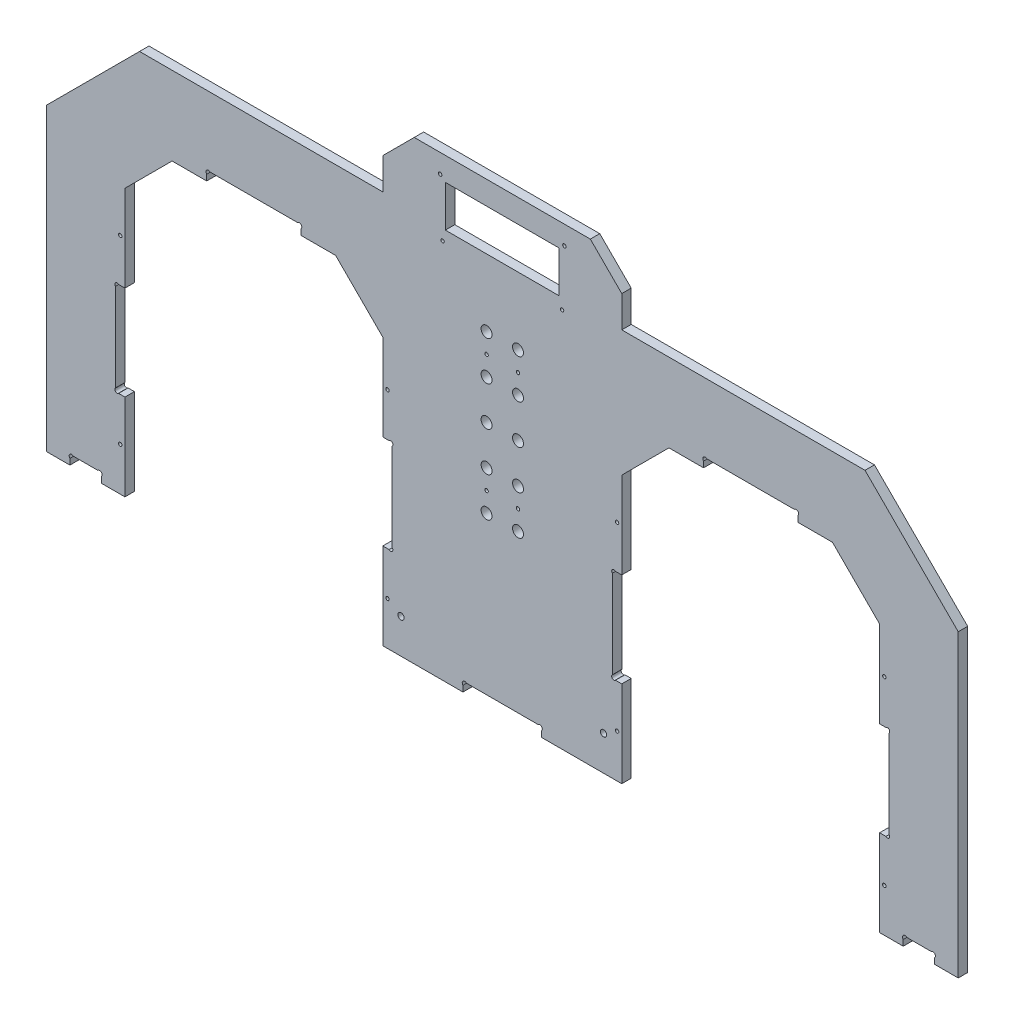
SolidWorks part; units mm, degrees
ref_plane "Plan de face" through (0, 0, 0) normal (0, 0, 1) x (1, 0, 0)
ref_plane "Plan de dessus" through (0, 0, 0) normal (0, 1, 0) x (1, 0, 0)
ref_plane "Plan de droite" through (0, 0, 0) normal (1, 0, 0) x (0, 0, -1)
sketch "Esquisse1" plane through (0, 0, 0) normal (0, 0, 1) x (1, 0, 0)
  line L0 (0, -73.5394) -> (0, 308.8632) construction
  line L1 (290, -73.5394) -> (290, 262.0971) construction
  line L2 (240, 170) -> (240, 115)
  line L3 (346.4556, 0) -> (-29.7377, 0) construction
  line L4 (329.5923, 200) -> (-38.643, 200) construction
  line L5 (76, -52.8899) -> (76, 272.6787) construction
  line L6 (240, 204.2828) -> (240, -52.8899) construction
  line L7 (345.8617, 250) -> (65.5103, 250) construction
  line L8 (56, 290) -> (76, 270)
  line L9 (230.7107, 250) -> (290, 190.7107)
  line L10 (210, 200) -> (240, 170)
  line L11 (158, 29.6271) -> (158, -21.2823) construction
  line L12 (76, 270) -> (76, 250)
  line L13 (76, 250) -> (230.7107, 250)
  line L14 (240, 0) -> (255, 0)
  line L15 (290, 190.7107) -> (290, 0)
  line L16 (210, 200) -> (188, 200)
  line L17 (76, 170) -> (76, 115)
  line L18 (106, 200) -> (76, 170)
  line L19 (-51.0394, 290) -> (95.8133, 290) construction
  line L20 (28.6952, 206) -> (-15.7759, 206) construction
  line L21 (70, -33.1466) -> (70, 219.4286) construction
  line L22 (246, -33.1466) -> (246, 209.1108) construction
  line L23 (329.5923, 206) -> (56, 206) construction
  line L24 (224.6367, 85) -> (240, 85) construction
  line L25 (10, 107.7849) -> (10, 210.6288) construction
  line L26 (220.769, 115) -> (256.0249, 115) construction
  line L27 (246, 115) -> (229.1687, 98.1687) construction
  line L28 (-10, 107.7849) -> (-10, 173.6131) construction
  line L29 (240, 115) -> (244, 115)
  line L30 (246, 113) -> (246, 57)
  line L31 (244, 55) -> (240, 55)
  line L32 (224.6367, 142.5) -> (251.0798, 142.5) construction
  line L33 (240, 55) -> (240, 0)
  line L34 (243, 154.5331) -> (243, 137.1541) construction
  line L35 (72, 55) -> (76, 55)
  line L36 (70, 113) -> (70, 57)
  line L37 (76, 115) -> (72, 115)
  line L38 (128, 206) -> (143.7574, 190.2426) construction
  line L39 (76, 55) -> (76, 0)
  line L40 (158, 200) -> (158, 181.4071) construction
  line L41 (128, 210.6288) -> (128, 181.4071) construction
  line L42 (128, 203.7373) -> (128, 200)
  line L43 (188, 203.7373) -> (188, 200)
  line L44 (130.2627, 206) -> (185.7373, 206)
  line L45 (265, 0) -> (265, -17.758) construction
  line L46 (128, 200) -> (106, 200)
  line L47 (275, 9.5721) -> (275, -17.758) construction
  line L48 (314.8495, 6) -> (-29.7377, 6) construction
  line L49 (275, 6) -> (264.8511, -4.1489) construction
  line L50 (275, 3.7373) -> (275, 0)
  line L51 (255, 3.7373) -> (255, 0)
  line L52 (257.2627, 6) -> (272.7373, 6)
  line L53 (275, 0) -> (290, 0)
  line L54 (25, 9.5721) -> (25, -17.758) construction
  line L55 (20.3719, 22) -> (71, 22) construction
  line L56 (64.4, -11.5037) -> (64.4, 47.2478) construction
  line L57 (25, 6) -> (7.4963, -11.5037) construction
  line L58 (25, 3.7373) -> (25, 0)
  line L59 (25, 0) -> (76, 0)
  line L60 (-56, 290) -> (-76, 270)
  line L61 (-76, 270) -> (-76, 250)
  line L62 (-76, 250) -> (-230.7107, 250)
  line L63 (-230.7107, 250) -> (-290, 190.7107)
  line L64 (-290, 190.7107) -> (-290, 0)
  line L65 (-275, 0) -> (-290, 0)
  line L66 (-257.2627, 6) -> (-272.7373, 6)
  line L67 (-255, 3.7373) -> (-255, 0)
  line L68 (-275, 3.7373) -> (-275, 0)
  line L69 (-240, 0) -> (-255, 0)
  line L70 (-240, 55) -> (-240, 0)
  line L71 (-244, 55) -> (-240, 55)
  line L72 (-246, 113) -> (-246, 57)
  line L73 (-240, 115) -> (-244, 115)
  line L74 (-240, 170) -> (-240, 115)
  line L75 (-210, 200) -> (-240, 170)
  line L76 (-128, 200) -> (-106, 200)
  line L77 (-130.2627, 206) -> (-185.7373, 206)
  line L78 (-188, 203.7373) -> (-188, 200)
  line L79 (-128, 203.7373) -> (-128, 200)
  line L80 (-106, 200) -> (-76, 170)
  line L81 (-76, 170) -> (-76, 115)
  line L82 (-76, 55) -> (-76, 0)
  line L83 (-76, 115) -> (-72, 115)
  line L84 (-70, 113) -> (-70, 57)
  line L85 (-72, 55) -> (-76, 55)
  line L86 (-25, 0) -> (-76, 0)
  line L87 (-25, 3.7373) -> (-25, 0)
  line L88 (-56, 290) -> (56, 290)
  line L89 (-22.7373, 6) -> (22.7373, 6)
  line L90 (-210, 200) -> (-188, 200)
  line L91 (28.6952, 211) -> (-15.7759, 211) construction
  line L92 (0, 262) -> (31.0144, 262) construction
  line L93 (-42, 282) -> (42, 282) construction
  line L94 (-42, 282) -> (-42, 238) construction
  line L95 (-42, 238) -> (42, 238) construction
  line L96 (42, 282) -> (42, 238) construction
  line L97 (-42, 282) -> (42, 238) construction
  line L98 (3.472, 118.5) -> (28.6952, 118.5) construction
  line L99 (28.6952, 193.5) -> (3.472, 193.5) construction
  line L100 (-42, 238) -> (42, 282) construction
  line L101 (-36.2, 275.15) -> (36.2, 275.15)
  line L102 (-36.2, 275.15) -> (-36.2, 248.85)
  line L103 (-36.2, 248.85) -> (36.2, 248.85)
  line L104 (36.2, 275.15) -> (36.2, 248.85)
  line L105 (-36.2, 275.15) -> (36.2, 248.85) construction
  line L106 (-36.2, 248.85) -> (36.2, 275.15) construction
  arc A0 (246, 113) -> (244, 115) centre (245, 114) ccw
  arc A1 (246, 57) -> (244, 55) centre (245, 56) cw
  circle A2 centre (64.4, 22) radius 2
  circle A3 centre (10, 106) radius 3.475
  circle A4 centre (-64.4, 22) radius 2
  circle A5 centre (243, 142.5) radius 1.1
  circle A6 centre (-10, 106) radius 3.475
  circle A7 centre (10, 131) radius 3.475
  circle A8 centre (-10, 131) radius 3.475
  circle A9 centre (243, 27.5) radius 1.1
  circle A10 centre (10, 156) radius 3.475
  circle A11 centre (-10, 156) radius 3.475
  circle A12 centre (10, 181) radius 3.475
  circle A13 centre (-10, 181) radius 3.475
  circle A14 centre (10, 206) radius 3.475
  circle A15 centre (-10, 206) radius 3.475
  arc A16 (70, 57) -> (72, 55) centre (71, 56) ccw
  arc A17 (70, 113) -> (72, 115) centre (71, 114) cw
  arc A18 (130.2627, 206) -> (128, 203.7373) centre (129.1314, 204.8686) ccw
  arc A19 (185.7373, 206) -> (188, 203.7373) centre (186.8686, 204.8686) cw
  arc A20 (275, 3.7373) -> (272.7373, 6) centre (273.8686, 4.8686) ccw
  arc A21 (255, 3.7373) -> (257.2627, 6) centre (256.1314, 4.8686) cw
  circle A22 centre (73, 27.5) radius 1.1
  arc A23 (25, 3.7373) -> (22.7373, 6) centre (23.8686, 4.8686) ccw
  arc A24 (-255, 3.7373) -> (-257.2627, 6) centre (-256.1314, 4.8686) ccw
  arc A25 (-275, 3.7373) -> (-272.7373, 6) centre (-273.8686, 4.8686) cw
  circle A26 centre (73, 142.5) radius 1.1
  arc A27 (-246, 57) -> (-244, 55) centre (-245, 56) ccw
  arc A28 (-246, 113) -> (-244, 115) centre (-245, 114) cw
  arc A29 (-185.7373, 206) -> (-188, 203.7373) centre (-186.8686, 204.8686) ccw
  arc A30 (-130.2627, 206) -> (-128, 203.7373) centre (-129.1314, 204.8686) cw
  circle A31 centre (-243, 142.5) radius 1.1
  arc A32 (-70, 113) -> (-72, 115) centre (-71, 114) ccw
  arc A33 (-70, 57) -> (-72, 55) centre (-71, 56) cw
  circle A34 centre (-243, 27.5) radius 1.1
  arc A35 (-25, 3.7373) -> (-22.7373, 6) centre (-23.8686, 4.8686) cw
  circle A36 centre (-73, 27.5) radius 1.1
  circle A37 centre (-73, 142.5) radius 1.1
  circle A38 centre (10, 193.5) radius 1.1
  circle A39 centre (10, 118.5) radius 1.1
  circle A40 centre (-10, 193.5) radius 1.1
  circle A41 centre (-10, 118.5) radius 1.1
  circle A42 centre (-39.5, 278) radius 1.1
  circle A43 centre (-38, 242) radius 1.1
  circle A44 centre (38, 242) radius 1.1
  circle A45 centre (39.5, 278) radius 1.1
  point P24 (290, 230)
  point P200 (0, 262)
  dimension "D2" = 82
  dimension "D8" = 50
  dimension "D9" = 20
  dimension "D10" = 40
  dimension "D11" = 45
  dimension "D13" = 5
  dimension "D22" = 3
  dimension "D24" = 30
  dimension "D26" = 6
  dimension "D29" = 25
  dimension "D33" = 8
  dimension "D37" = 24
  dimension "D39" = 2.5
  dimension "D41" = 4
  dimension "D43" = 44
  dimension "D1" = 290
  dimension "D3" = 76
  dimension "D4" = 200
  dimension "D5" = 164
  dimension "D6" = 250
  dimension "D7" = 10
  dimension "D12" = 12.5
  dimension "D14" = 45
  dimension "D15" = 30
  dimension "D16" = 20
  dimension "D17" = 6
  dimension "D18" = 6
  dimension "D19" = 6
  dimension "D20" = 30
  dimension "D21" = 45
  dimension "D23" = 27.5
  dimension "D25" = 45
  dimension "D27" = 10
  dimension "D28" = 45
  dimension "D30" = 22
  dimension "D31" = 5.6
  dimension "D32" = 45
  dimension "D34" = 5
  dimension "D35" = 27
  dimension "D36" = 75
  dimension "D40" = 4
  dimension "D42" = 4
extrude "Boss.-Extru.1" add sketch "Esquisse1" along normal blind 6
